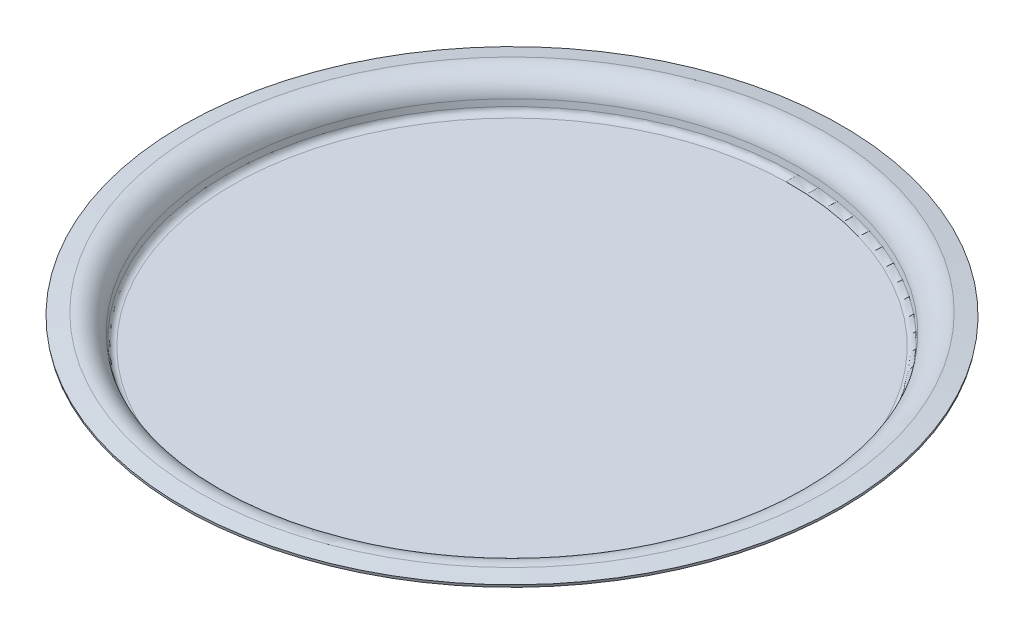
SolidWorks part; units mm, degrees
ref_plane "Plan1" through (0, 0, 0) normal (0, 0, 1) x (1, 0, 0)
ref_plane "Plan2" through (0, 0, 0) normal (0, 1, 0) x (1, 0, 0)
ref_plane "Plan3" through (0, 0, 0) normal (1, 0, 0) x (0, 0, -1)
sketch "Esquisse1" plane through (0, 0, 0) normal (0, 0, 1) x (1, 0, 0)
  line L0 (0, 40) -> (0, -10) construction
  line L1 (0, 0) -> (44, 0)
  line L2 (0, 0) -> (0, 0.4)
  line L3 (0, 0.4) -> (43.6644, 0.4)
  line L4 (44, 0) -> (44.8881, 5.0366)
  line L5 (43.6644, 0.4) -> (44.5636, 5.5)
  line L6 (44.5636, 5.5) -> (50.5, 4.4533)
  line L7 (50.5, 4.4533) -> (50.4305, 4.0593)
  line L8 (50.4305, 4.0593) -> (44.8881, 5.0366)
  point P12 (44, 0)
  point P17 (44.5636, 5.5)
  dimension "D4" = 0.4
  dimension "D5" = 0.4
  dimension "D1" = 0.4
  dimension "D2" = 88
  dimension "D3" = 89.1273
  dimension "D6" = 5.5
  dimension "D7" = 101
revolve "Base-Révolution" add sketch "Esquisse1" angle 360 about L0
fillet "Congé1" radius 3.4
fillet "Congé2" radius 1
fillet "Congé3" radius 3
fillet "Congé4" radius 1.4
